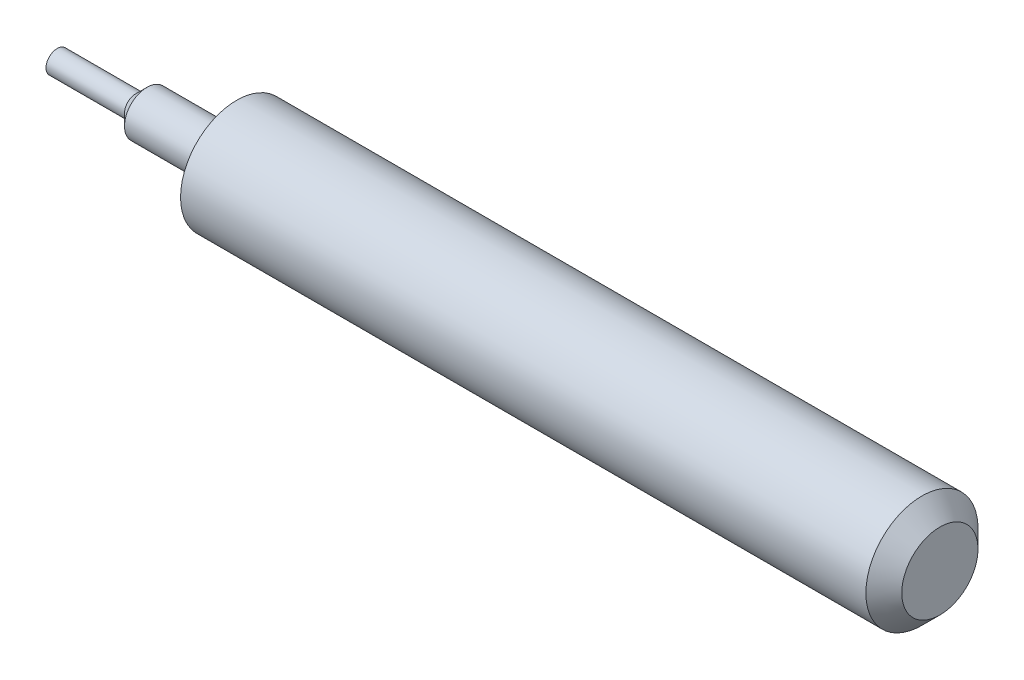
SolidWorks part; units mm, degrees
ref_plane "Front" through (0, 0, 0) normal (0, 0, 1) x (1, 0, 0)
ref_plane "Top" through (0, 0, 0) normal (0, 1, 0) x (1, 0, 0)
ref_plane "Right" through (0, 0, 0) normal (1, 0, 0) x (0, 0, -1)
sketch "Sketch1" plane through (0, 0, 0) normal (0, 1, 0) x (1, 0, 0)
  line L0 (-1000, 0) -> (49000, 0) construction
  line L1 (0, 3.175) -> (0, 7.9375)
  line L2 (0, 7.9375) -> (99.568, 7.9375)
  line L3 (99.568, 7.9375) -> (99.568, 0)
  line L4 (99.568, 0) -> (0, 0)
  line L5 (0, 0) -> (-25.4, 0)
  line L6 (-25.4, 0) -> (-25.4, 1.5875)
  line L7 (-25.4, 1.5875) -> (-14.2875, 1.5875)
  line L8 (-14.2875, 1.5875) -> (-12.7, 3.175)
  line L9 (-12.7, 3.175) -> (0, 3.175)
  line L10 (0, 0) -> (0, 3.175) construction
  point P5 (-25.4, 0.7937)
  dimension "D1" = 15.875
  dimension "D2" = 99.568
  dimension "D3" = 3.175
  dimension "D4" = 6.35
  dimension "D5" = 45
  dimension "D6" = 12.7
  dimension "D7" = 25.4
revolve "Revolve1" add sketch "Sketch1" angle 360 about L0
chamfer "Chamfer1" distance 2.54 angle 45 1 edges at (99.568, 0, 7.9375)
